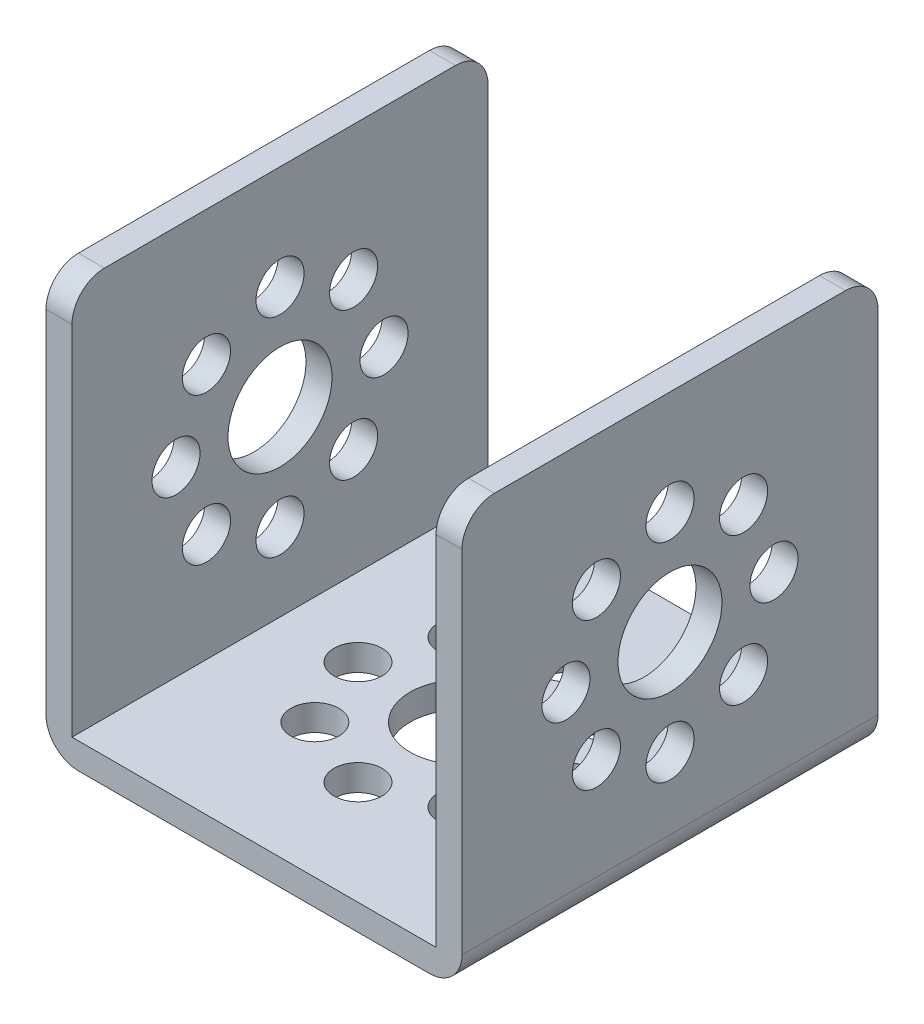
SolidWorks part; units mm, degrees
ref_plane "Front Plane" through (0, 0, 0) normal (0, 0, 1) x (1, 0, 0)
ref_plane "Top Plane" through (0, 0, 0) normal (0, 1, 0) x (1, 0, 0)
ref_plane "Right Plane" through (0, 0, 0) normal (1, 0, 0) x (0, 0, -1)
sketch "Sketch3" plane through (0, 0, 0) normal (0, 0, 1) x (1, 0, 0)
  line L0 (2.5, 0) -> (29.5, 0)
  line L1 (32, 2.5) -> (32, 32)
  line L2 (32, 32) -> (30, 32)
  line L3 (30, 32) -> (30, 2)
  line L4 (30, 2) -> (2, 2)
  line L5 (2, 2) -> (2, 32)
  line L6 (2, 32) -> (0, 32)
  line L7 (0, 32) -> (0, 2.5)
  arc A0 (32, 2.5) -> (29.5, 0) centre (29.5, 2.5) cw
  arc A1 (0, 2.5) -> (2.5, 0) centre (2.5, 2.5) ccw
  point P11 (32, 0)
  point P14 (0, 0)
  dimension "D7" = 2.5
  dimension "D8" = 2.5
  dimension "D1" = 2
  dimension "D2" = 2
  dimension "D3" = 32
  dimension "D4" = 32
  dimension "D5" = 32
  dimension "D6" = 30
extrude "Extrude1" add sketch "Sketch3" along normal blind 32
fillet "Fillet1" radius 2.5 1 edges at (31, 32, 32)
fillet "Fillet2" radius 2.5 1 edges at (1, 32, 32)
fillet "Fillet3" radius 2.5 1 edges at (1, 32, 0)
fillet "Fillet4" radius 2.5 1 edges at (31, 32, 0)
sketch "Sketch5" plane through (32, 0, 0) normal (1, 0, 0) x (0, 0, -1)
  line L0 (-29.5, 32) -> (-2.5, 32) construction
  circle A0 centre (-16, 16) radius 4
  circle A1 centre (-16, 8) radius 1.85
  circle A2 centre (-16, 24) radius 1.85
  circle A3 centre (-24, 16) radius 1.85
  circle A4 centre (-8, 16) radius 1.85
  circle A5 centre (-10.34, 21.66) radius 1.85
  circle A6 centre (-21.66, 21.66) radius 1.85
  circle A7 centre (-10.34, 10.34) radius 1.85
  circle A8 centre (-21.66, 10.34) radius 1.85
  arc A9 (-29.5, 32) -> (-32, 29.5) centre (-29.5, 29.5) ccw construction
  point P2 (-16, 32)
  dimension "D1" = 8
  dimension "D6" = 3.7
  dimension "D7" = 3.7
  dimension "D9" = 3.7
  dimension "D11" = 3.7
  dimension "D12" = 3.7
  dimension "D16" = 3.7
  dimension "D18" = 3.7
  dimension "D19" = 3.7
  dimension "D2" = 16
  dimension "D3" = 16
  dimension "D4" = 8
  dimension "D5" = 8
  dimension "D8" = 8
  dimension "D10" = 8
  dimension "D13" = 5.66
  dimension "D14" = 5.66
  dimension "D15" = 5.66
  dimension "D17" = 5.66
  dimension "D20" = 5.66
  dimension "D21" = 5.66
extrude "Cut-Extrude1" cut sketch "Sketch5" against normal blind 32
sketch "Sketch8" plane through (0, 2, 0) normal (0, 1, 0) x (1, 0, 0)
  circle A0 centre (16, -16) radius 4
  circle A1 centre (24, -16) radius 1.85
  circle A2 centre (8, -16) radius 1.85
  circle A3 centre (16, -8) radius 1.85
  circle A4 centre (16, -24) radius 1.85
  circle A5 centre (21.66, -10.34) radius 1.85
  circle A6 centre (21.66, -21.66) radius 1.85
  circle A7 centre (10.34, -21.66) radius 1.85
  circle A8 centre (10.34, -10.34) radius 1.85
  dimension "D1" = 8
  dimension "D4" = 3.7
  dimension "D5" = 3.7
  dimension "D6" = 3.7
  dimension "D7" = 3.7
  dimension "D12" = 3.7
  dimension "D13" = 3.7
  dimension "D14" = 3.7
  dimension "D15" = 3.7
  dimension "D2" = 16
  dimension "D3" = 14
  dimension "D8" = 8
  dimension "D9" = 8
  dimension "D10" = 8
  dimension "D11" = 8
  dimension "D16" = 5.66
  dimension "D17" = 5.66
  dimension "D18" = 5.66
  dimension "D19" = 5.66
  dimension "D20" = 5.66
  dimension "D21" = 5.66
  dimension "D22" = 5.66
  dimension "D23" = 5.66
extrude "Cut-Extrude2" cut sketch "Sketch8" against normal blind 2
